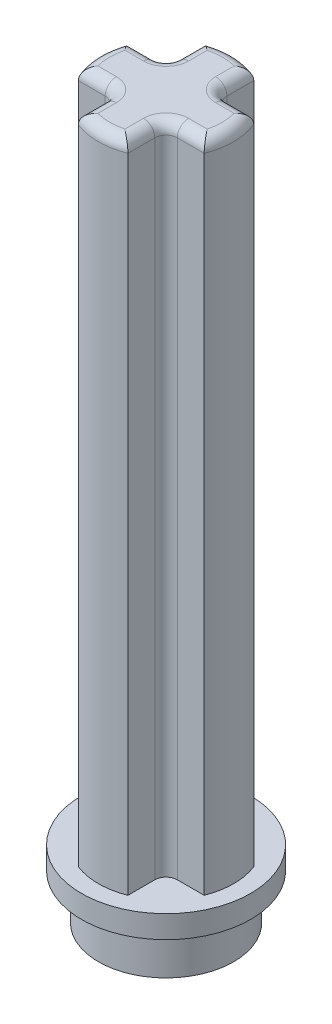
SolidWorks part; units mm, degrees
ref_plane "Front Plane" through (0, 0, 0) normal (0, 0, 1) x (1, 0, 0)
ref_plane "Top Plane" through (0, 0, 0) normal (0, 1, 0) x (1, 0, 0)
ref_plane "Right Plane" through (0, 0, 0) normal (1, 0, 0) x (0, 0, -1)
sketch "Sketch1" plane through (0, 0, 0) normal (0, 1, 0) x (1, 0, 0)
  line L8 (-2.2328, 0.88) -> (-0.88, 0.88)
  line L9 (2.2328, -0.88) -> (0.88, -0.88)
  line L10 (-0.88, 2.2328) -> (-0.88, 0.88)
  line L11 (-0.88, -0.88) -> (-0.88, -2.2328)
  line L12 (0.88, -2.2328) -> (0.88, -0.88)
  line L13 (0.88, 0.88) -> (2.2328, 0.88)
  line L14 (0.88, 0.88) -> (0.88, 2.2328)
  line L15 (-0.88, -0.88) -> (-2.2328, -0.88)
  arc A4 (2.2328, -0.88) -> (2.2328, 0.88) centre (0, 0) ccw
  arc A5 (0.88, 2.2328) -> (-0.88, 2.2328) centre (0, 0) ccw
  arc A6 (-2.2328, 0.88) -> (-2.2328, -0.88) centre (0, 0) ccw
  arc A7 (-0.88, -2.2328) -> (0.88, -2.2328) centre (0, 0) ccw
  dimension "D1" = 0.88
  dimension "D2" = 1.76
  dimension "D3" = 0.88
  dimension "D4" = 1.76
extrude "Boss-Extrude1" add sketch "Sketch1" along normal blind 23.2
fillet "Fillet7" radius 0.4 16 edges at (0, 23.2, -2.4) (0.88, 23.2, -1.5564) (1.5564, 23.2, -0.88) (2.4, 23.2, 0) (1.5564, 23.2, 0.88) (0.88, 23.2, 1.5564) (0, 23.2, 2.4) (-0.88, 23.2, 1.5564) (-1.5564, 23.2, 0.88) (-2.4, 23.2, 0) (-1.5564, 23.2, -0.88) (-0.88, 23.2, -1.5564) (-0.88, 11.6, -0.88) (0.88, 11.6, 0.88) (-0.88, 11.6, 0.88) (0.88, 11.6, -0.88)
sketch "Sketch2" plane through (0, 0, 0) normal (0, -1, 0) x (1, 0, 0)
  circle A0 centre (0, 0) radius 3
extrude "Boss-Extrude2" add sketch "Sketch2" along normal blind 0.8
sketch "Sketch3" plane through (0, -0.8, 0) normal (0, -1, 0) x (1, 0, 0)
  circle A0 centre (0, 0) radius 2.4
  circle A1 centre (0, 0) radius 1.6
extrude "Boss-Extrude3" add sketch "Sketch3" along normal blind 1.6
